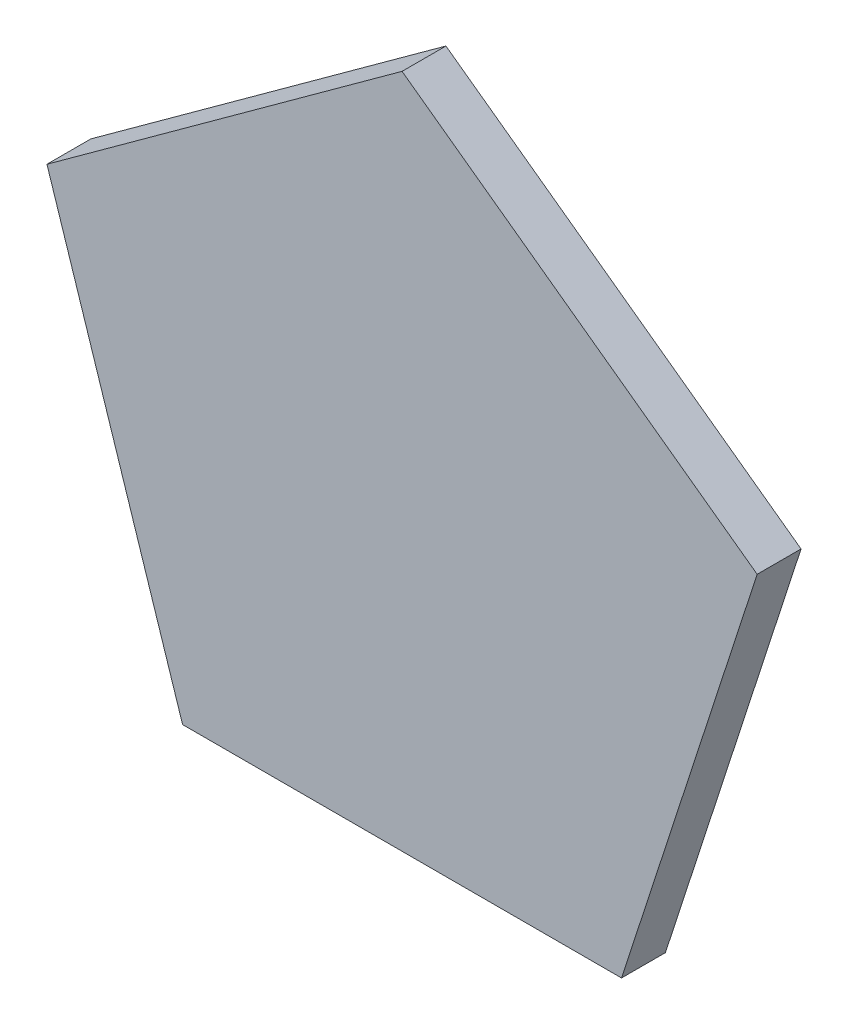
SolidWorks part; units mm, degrees
ref_plane "Front Plane" through (0, 0, 0) normal (0, 0, 1) x (1, 0, 0)
ref_plane "Top Plane" through (0, 0, 0) normal (0, 1, 0) x (1, 0, 0)
ref_plane "Right Plane" through (0, 0, 0) normal (1, 0, 0) x (0, 0, -1)
sketch "Sketch1" plane through (0, 0, 0) normal (0, 0, 1) x (1, 0, 0)
  line L1 (20.549, 6.6768) -> (0, 21.6065)
  line L2 (0, 21.6065) -> (-20.549, 6.6768)
  line L3 (-20.549, 6.6768) -> (-12.7, -17.4801)
  line L4 (-12.7, -17.4801) -> (12.7, -17.4801)
  line L5 (12.7, -17.4801) -> (20.549, 6.6768)
  circle A0 centre (0, 0) radius 17.4801 construction
  dimension "D1" = 25.4
extrude "Boss-Extrude1" add sketch "Sketch1" along normal mid plane 2.54
